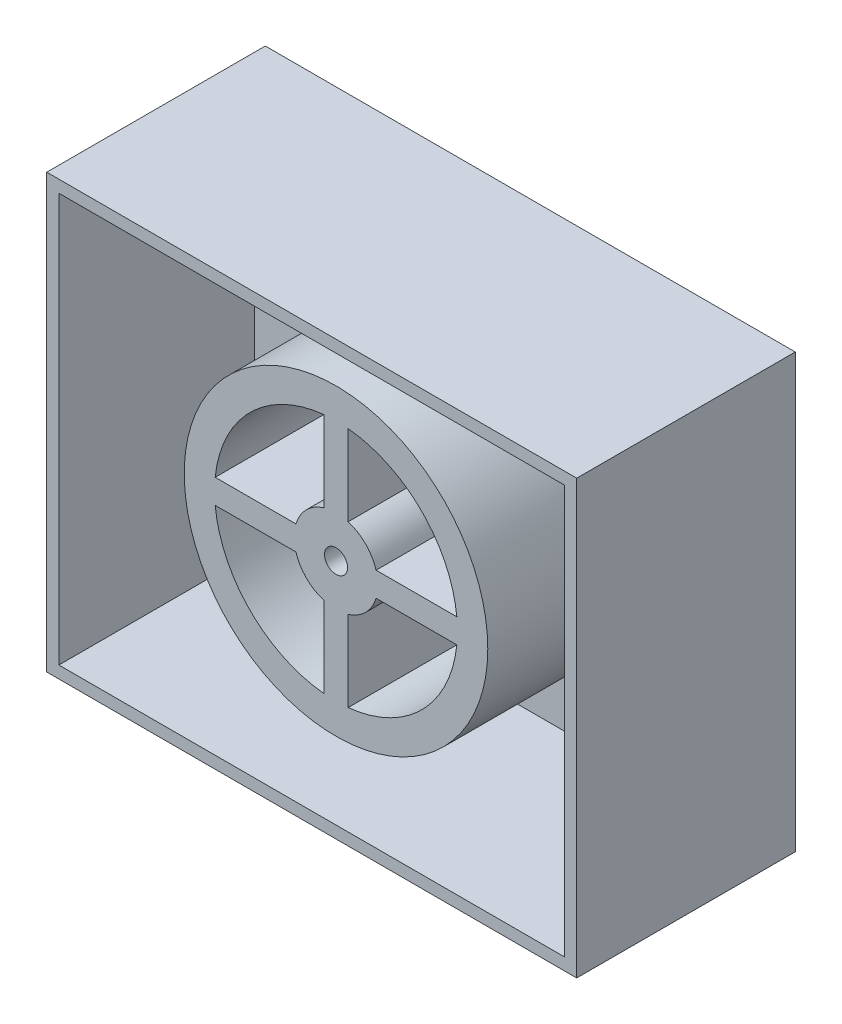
SolidWorks part; units mm, degrees
ref_plane "Front Plane" through (0, 0, 0) normal (0, 0, 1) x (1, 0, 0)
ref_plane "Top Plane" through (0, 0, 0) normal (0, 1, 0) x (1, 0, 0)
ref_plane "Right Plane" through (0, 0, 0) normal (1, 0, 0) x (0, 0, -1)
sketch "Sketch1" plane through (0, 0, 0) normal (0, 0, 1) x (1, 0, 0)
  line L0 (-10.186, 5.2158) -> (14.814, 5.2158) construction
  line L1 (-3.5822, 3.2158) -> (9.7137, 3.2158)
  line L2 (-3.5822, 7.2158) -> (9.7137, 7.2158)
  line L3 (-10.186, 7.2158) -> (14.814, 7.2158) construction
  line L4 (-10.186, 3.2158) -> (14.814, 3.2158) construction
  line L5 (-12.186, -1.388) -> (-12.186, -14.6839)
  line L6 (-8.186, -1.388) -> (-8.186, -14.6839)
  line L7 (-10.186, 5.2158) -> (-10.186, -19.7842) construction
  line L8 (-16.7898, 7.2158) -> (-30.0858, 7.2158)
  line L9 (-16.7898, 3.2158) -> (-30.0858, 3.2158)
  line L10 (-10.186, 5.2158) -> (-35.186, 5.2158) construction
  line L11 (-8.186, 11.8196) -> (-8.186, 25.1156)
  line L12 (-12.186, 11.8196) -> (-12.186, 25.1156)
  line L13 (-10.186, 5.2158) -> (-10.186, 30.2158) construction
  circle A0 centre (-10.186, 5.2158) radius 25
  arc A1 (-30.0858, 3.2158) -> (-12.186, -14.6839) centre (-10.186, 5.2158) ccw
  circle A3 centre (-10.186, 5.2158) radius 1.9
  arc A4 (-16.7898, 3.2158) -> (-12.186, -1.388) centre (-10.186, 5.2158) ccw
  circle A5 centre (-10.186, 5.2158) radius 20 construction
  circle A6 centre (-10.186, 5.2158) radius 6.9 construction
  arc A7 (-8.186, -1.388) -> (-3.5822, 3.2158) centre (-10.186, 5.2158) ccw
  arc A8 (-8.186, -14.6839) -> (9.7137, 3.2158) centre (-10.186, 5.2158) ccw
  arc A9 (9.7137, 7.2158) -> (-8.186, 25.1156) centre (-10.186, 5.2158) ccw
  arc A10 (-3.5822, 7.2158) -> (-8.186, 11.8196) centre (-10.186, 5.2158) ccw
  arc A11 (-12.186, 25.1156) -> (-30.0858, 7.2158) centre (-10.186, 5.2158) ccw
  arc A12 (-12.186, 11.8196) -> (-16.7898, 7.2158) centre (-10.186, 5.2158) ccw
  point P34 (-10.186, 5.2158)
  dimension "D1" = 5
  dimension "D3" = 2
  dimension "D2" = 5
  dimension "D6" = 50
  dimension "D4" = 2
  dimension "D5" = 4
extrude "Boss-Extrude1" add sketch "Sketch1" along normal blind 25
sketch "Sketch2" plane through (0, 0, 0) normal (0, 0, -1) x (-1, 0, 0)
  line L1 (-33.4619, -30.4368) -> (53.8339, -30.4368)
  line L2 (-33.4619, -30.4368) -> (-33.4619, 40.8684)
  line L3 (-33.4619, 40.8684) -> (53.8339, 40.8684)
  line L4 (53.8339, -30.4368) -> (53.8339, 40.8684)
  line L5 (-33.4619, -30.4368) -> (53.8339, 40.8684) construction
  line L6 (-33.4619, 40.8684) -> (53.8339, -30.4368) construction
  point P0 (10.186, 5.2158)
extrude "Boss-Extrude2" add sketch "Sketch2" along normal blind 7
sketch "Sketch3" plane through (0, 0, 0) normal (0, 0, 1) x (1, 0, 0)
  line L0 (33.4619, -30.4368) -> (-53.8339, -30.4368) construction
  line L1 (33.4619, 40.8684) -> (33.4619, -30.4368) construction
  line L2 (-53.8339, 40.8684) -> (33.4619, 40.8684) construction
  line L3 (-53.8339, -30.4368) -> (-53.8339, 40.8684) construction
  line L4 (33.4619, -30.4368) -> (-53.8339, -30.4368)
  line L5 (33.4619, 40.8684) -> (33.4619, -30.4368)
  line L6 (-53.8339, 40.8684) -> (33.4619, 40.8684)
  line L7 (-53.8339, -30.4368) -> (-53.8339, 40.8684)
  line L8 (-51.8339, 38.8684) -> (31.4619, 38.8684)
  line L9 (31.4619, 38.8684) -> (31.4619, -28.4368)
  line L10 (31.4619, -28.4368) -> (-51.8339, -28.4368)
  line L11 (-51.8339, -28.4368) -> (-51.8339, 38.8684)
  dimension "D1" = 2
extrude "Boss-Extrude3" add sketch "Sketch3" along normal blind 29 contours L4 L7 L6 L5 | L11 L8 L9 L10
sketch "Sketch4" plane through (0, 0, 0) normal (0, 0, 1) x (1, 0, 0)
  line L11 (31.4619, 38.8684) -> (-51.8339, 38.8684)
  line L12 (-51.8339, 38.8684) -> (-51.8339, -28.4368)
  line L13 (-51.8339, -28.4368) -> (31.4619, -28.4368)
  line L14 (31.4619, -28.4368) -> (31.4619, 38.8684)
  line L15 (-48.6339, -25.2368) -> (28.2619, -25.2368)
  line L16 (28.2619, -25.2368) -> (28.2619, 35.6684)
  line L17 (28.2619, 35.6684) -> (-48.6339, 35.6684)
  line L18 (-48.6339, 35.6684) -> (-48.6339, -25.2368)
  line L19 (-48.6339, -25.2368) -> (28.2619, -25.2368)
  line L20 (28.2619, -25.2368) -> (28.2619, 35.6684)
  line L21 (28.2619, 35.6684) -> (-48.6339, 35.6684)
  line L22 (-48.6339, 35.6684) -> (-48.6339, -25.2368)
  dimension "D1" = 3.2
  dimension "D2" = 3.2
extrude "Cut-Extrude1" cut sketch "Sketch4" against normal blind 4
